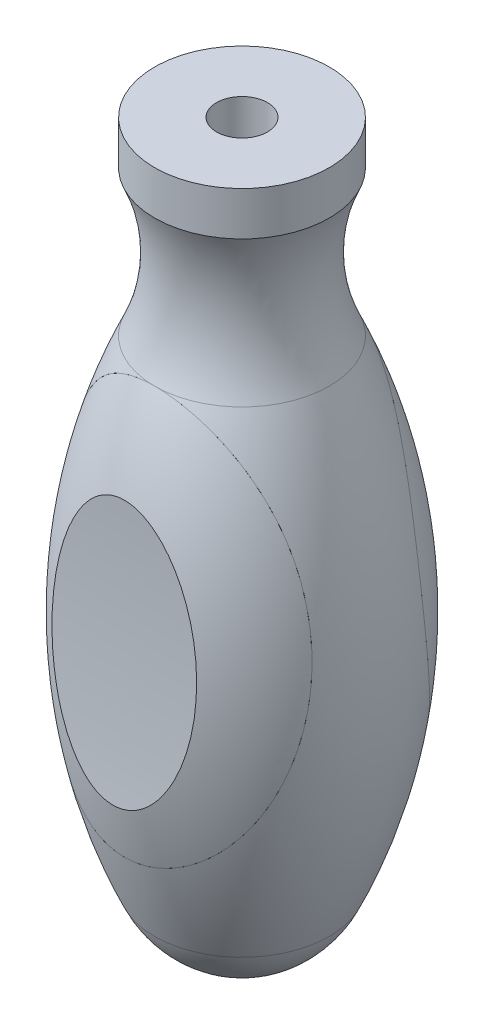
SolidWorks part; units mm, degrees
other "Grip2"
other "Grip1"
other "MainBody"
ref_plane "Front Plane" through (0, 0, 0) normal (0, 0, 1) x (1, 0, 0)
ref_plane "Top Plane" through (0, 0, 0) normal (0, 1, 0) x (1, 0, 0)
ref_plane "Right Plane" through (0, 0, 0) normal (1, 0, 0) x (0, 0, -1)
sketch "BBox" plane through (0, 0, 0) normal (1, 0, 0) x (0, 0, -1)
  line L4 (0, 0) -> (0, 220) construction
  line L5 (0, 100) -> (12, 100) construction
  line L6 (12, 100) -> (12, 0)
  line L7 (12, 0) -> (0, 0)
  line L8 (0, 220) -> (3.5, 220)
  line L9 (3.5, 220) -> (3.5, 100)
  dimension "D1" = 220
  dimension "D2" = 100
  dimension "D3" = 12
  dimension "D4" = 3.5
sketch "Handle" plane through (0, 0, 0) normal (1, 0, 0) x (0, 0, -1)
  line L4 (12, 100) -> (12, 94)
  line L5 (12, 100) -> (12, 0) construction
  line L7 (12, 100) -> (0, 100)
  line L8 (0, 100) -> (0, 0)
  arc A0 (12, 94) -> (12, 74) centre (34.2313, 84) ccw
  arc A1 (12, 74) -> (12, 8.5) centre (-60.8075, 41.25) cw
  arc A2 (12, 8.5) -> (0, 0) centre (-1.2238, 14.4483) cw
  dimension "D1" = 8.5
  dimension "D2" = 14.5
  dimension "D3" = 6
  dimension "D4" = 20
sketch "Grips" plane through (0, 0, 0) normal (1, 0, 0) x (0, 0, -1)
  line L0 (12, 74) -> (32.9937, 74)
  line L1 (32.9937, 74) -> (32.9937, 20)
  line L2 (32.9937, 20) -> (16.1466, 20)
  line L3 (0, 0) -> (0, 99.8972) construction
  line L4 (-32.9937, 20) -> (-16.1466, 20)
  line L5 (-32.9937, 74) -> (-32.9937, 20)
  line L6 (-12, 74) -> (-32.9937, 74)
  arc A0 (12, 74) -> (16.1466, 20) centre (67.4577, 51.0993) ccw
  arc A1 (12, 8.5) -> (12, 74) centre (-60.8075, 41.25) ccw construction
  arc A3 (-12, 74) -> (-16.1466, 20) centre (-67.4577, 51.0993) cw
  dimension "D1" = 60
  dimension "D2" = 20
revolve "Revolve1" add sketch "Handle" angle 360 about L8
sketch "Sketch4" plane through (0, 0, 0) normal (1, 0, 0) x (0, 0, -1)
  line L1 (3.5, 192.1141) -> (3.5, 30)
  line L2 (3.5, 30) -> (0, 30)
  line L3 (0, 0) -> (0, 220) construction
  line L4 (0, 30) -> (0, 220)
  line L5 (3.6557, 193.8721) -> (5.8443, 206.1279)
  line L7 (6, 207.8859) -> (6, 220)
  line L9 (0, 220) -> (6, 220)
  arc A0 (5.8443, 206.1279) -> (6, 207.8859) centre (-4, 207.8859) ccw
  arc A1 (3.6557, 193.8721) -> (3.5, 192.1141) centre (13.5, 192.1141) ccw
  point P12 (6, 207)
  point P16 (3.5, 193)
  dimension "D2" = 6
  dimension "D5" = 10
  dimension "D1" = 30
  dimension "D3" = 13
  dimension "D4" = 14
revolve "Revolve2" add sketch "Sketch4" angle 360 about L4
sketch "Sketch5" plane through (0, 0, 0) normal (0, 0, 1) x (1, 0, 0)
  line L0 (3.5, 80) -> (7.5, 75)
  line L1 (3.5, 30) -> (3.5, 192.1141) construction
  line L2 (7.5, 75) -> (7.5, 65)
  line L3 (7.5, 65) -> (3.5, 60)
  line L4 (3.5, 60) -> (-3.5, 60)
  line L5 (0, 0) -> (0, 220) construction
  line L6 (0, 60) -> (0, 80) construction
  line L7 (-3.5, 80) -> (3.5, 80)
  line L8 (-7.5, 65) -> (-3.5, 60)
  line L9 (-7.5, 75) -> (-7.5, 65)
  line L10 (-3.5, 80) -> (-7.5, 75)
  dimension "D1" = 7.5
  dimension "D2" = 60
  dimension "D3" = 20
  dimension "D4" = 10
extrude "Boss-Extrude2" add sketch "Sketch5" along normal mid plane 3
sketch "Sketch11" plane through (0, 0, 0) normal (1, 0, 0) x (0, 0, -1)
  line L0 (0.75, 220) -> (3.5, 187)
  line L1 (0, 220) -> (3.5, 220) construction
  line L2 (3.5, 220) -> (3.5, 100) construction
  line L3 (0.75, 220) -> (0, 220)
  line L4 (0, 220) -> (0, 230.4461) construction
  line L5 (0.75, 220) -> (10.893, 220)
  line L6 (10.893, 220) -> (10.893, 187)
  line L7 (10.893, 187) -> (3.5, 187)
  line L8 (-0.75, 220) -> (-10.893, 220)
  line L9 (-10.893, 220) -> (-10.893, 187)
  line L10 (-10.893, 187) -> (-3.5, 187)
  line L11 (-0.75, 220) -> (-3.5, 187)
  dimension "D1" = 33
  dimension "D2" = 0.75
extrude "Cut-Extrude4" cut sketch "Sketch11" against normal mid plane 20 contours L7 L6 L5 L0 | L11 L8 L9 L10
combine bodies "Combine1" operation type subtract main body 101 bodies to subtract 110
sketch "Sketch14" plane through (0, 0, 0) normal (1, 0, 0) x (0, 0, -1)
  line L0 (21.5489, 27) -> (20.6466, 27)
  line L1 (20.6466, 27) -> (20.6466, 62.5)
  line L2 (20.6466, 62.5) -> (16.1466, 62.5)
  line L3 (17.7466, 27) -> (20.6466, 27)
  arc A1 (12, 8.5) -> (12, 74) centre (-60.8075, 41.25) ccw construction
  arc A3 (16.1466, 62.5) -> (17.7466, 27) centre (215.9537, 53.7193) ccw
  dimension "D1" = 4.5
  dimension "D4" = 200
  dimension "D2" = 35.5
  dimension "D3" = 27
  dimension "D5" = 2.9
extrude "Cut-Extrude6" cut sketch "Sketch14" against normal through all both and the other way through all contours L2 A3 L3 L1
mirror "Mirror2" about plane through (0, 0, 0) normal (0, 0, 1) of "Cut-Extrude6"
split "Split1" trim tools "Grips" bodies to split 119 resulting bodies 112 113 114
sketch "Sketch13" plane through (0, 0, 0) normal (1, 0, 0) x (0, 0, -1)
  line L0 (0, 0) -> (0, 102.6432) construction
  line L1 (6.25, 60.8177) -> (12.5, 58.2682)
  line L2 (12.5, 58.2682) -> (12.5, 49.099)
  line L3 (12.5, 49.099) -> (6.25, 46.5495)
  line L4 (-12.5, 39) -> (-7.9779, 39)
  line L5 (12.5, 39) -> (15.0478, 32)
  line L6 (15.0478, 32) -> (9.3864, 26.7329)
  line L7 (0, 63.3672) -> (0, 44) construction
  line L8 (0, 39) -> (0, 18) construction
  line L9 (-15.0478, 32) -> (-9.3864, 26.7329)
  line L10 (-12.5, 39) -> (-15.0478, 32)
  line L11 (-12.5, 49.099) -> (-6.25, 46.5495)
  line L12 (-12.5, 58.2682) -> (-12.5, 49.099)
  line L13 (-6.25, 60.8177) -> (-12.5, 58.2682)
  line L14 (6.25, 58.6577) -> (10.5, 56.924)
  line L15 (10.5, 56.924) -> (10.5, 50.4432)
  line L16 (10.5, 50.4432) -> (6.25, 48.7095)
  line L17 (-10.5, 50.4432) -> (-6.25, 48.7095)
  line L18 (-10.5, 56.924) -> (-10.5, 50.4432)
  line L19 (-6.25, 58.6577) -> (-10.5, 56.924)
  line L20 (11.0996, 37) -> (12.7151, 32.5615)
  line L21 (12.7151, 32.5615) -> (9.103, 29.2009)
  line L22 (-12.7151, 32.5615) -> (-9.103, 29.2009)
  line L23 (-11.0996, 37) -> (-12.7151, 32.5615)
  line L24 (-11.0996, 37) -> (-8.2075, 37)
  line L25 (-6.25, 60.8177) -> (-6.25, 46.5495)
  line L26 (-7.9779, 39) -> (-9.3864, 26.7329)
  line L27 (7.9779, 39) -> (9.3864, 26.7329)
  line L28 (6.25, 60.8177) -> (6.25, 46.5495)
  line L29 (0, 63.3672) -> (-12.5, 58.2682) construction
  line L30 (0, 61.2072) -> (-10.5, 56.924) construction
  line L31 (0, 63.3672) -> (12.5, 58.2682) construction
  line L32 (0, 61.2072) -> (10.5, 56.924) construction
  line L33 (10.5, 50.4432) -> (0, 46.16) construction
  line L34 (12.5, 49.099) -> (0, 44) construction
  line L35 (-10.5, 50.4432) -> (0, 46.16) construction
  line L36 (-12.5, 49.099) -> (0, 44) construction
  line L37 (7.9779, 39) -> (12.5, 39)
  line L38 (-12.5, 39) -> (12.5, 39) construction
  line L39 (8.2075, 37) -> (11.0996, 37)
  line L40 (-11.0996, 37) -> (11.0996, 37) construction
  line L41 (-12.7151, 32.5615) -> (0, 20.7317) construction
  line L42 (-15.0478, 32) -> (0, 18) construction
  line L43 (12.7151, 32.5615) -> (0, 20.7317) construction
  line L44 (15.0478, 32) -> (0, 18) construction
  dimension "D1" = 12.5
  dimension "D2" = 12.5
  dimension "D3" = 18
  dimension "D4" = 44
  dimension "D5" = 19.3672
  dimension "D6" = 110
  dimension "D7" = 7
  dimension "D8" = 14
  dimension "D9" = 13.5
  dimension "D10" = 2
extrude "Boss-Extrude4" add sketch "Sketch13" along normal mid plane 3 draft 2 contours L25 L13 L12 L11 L17 L18 L19 | L26 L4 L10 L9 L22 L23 L24 | L27 L39 L20 L21 L6 L5 L37 | L1 L28 L14 L15 L16 L3 L2
